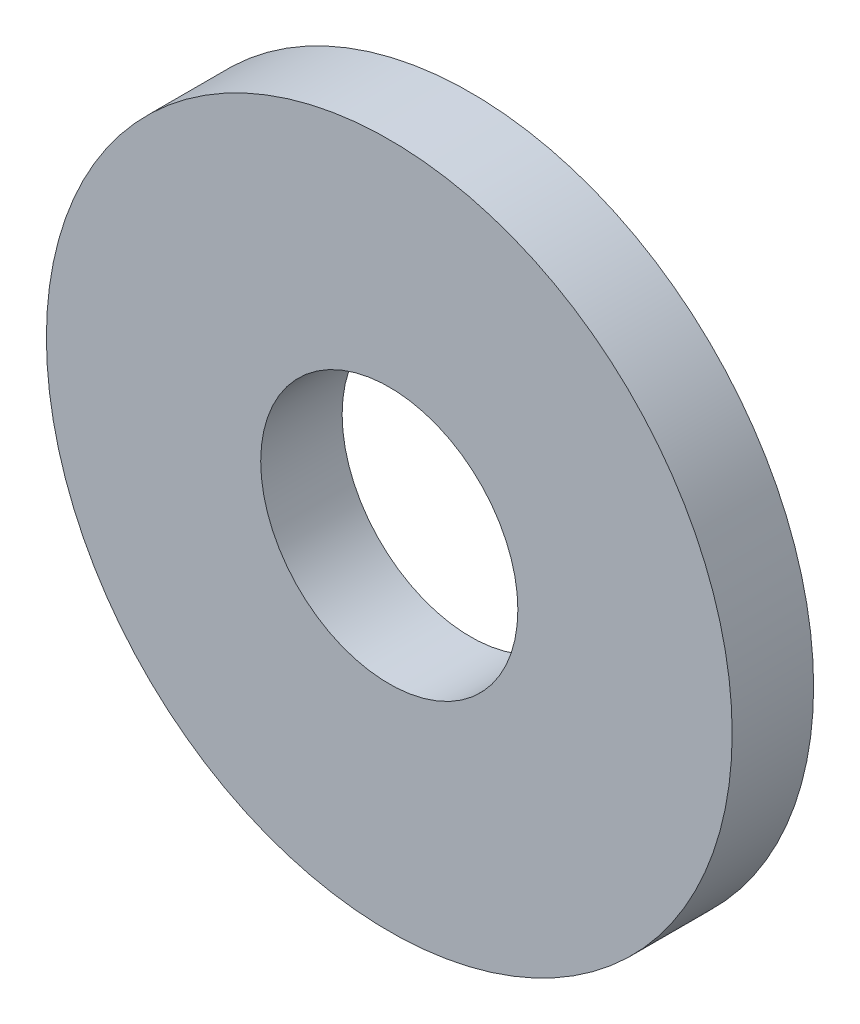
SolidWorks part; units mm, degrees
ref_plane "Plan1" through (0, 0, 0) normal (0, 0, 1) x (1, 0, 0)
ref_plane "Plan2" through (0, 0, 0) normal (0, 1, 0) x (1, 0, 0)
ref_plane "Plan3" through (0, 0, 0) normal (1, 0, 0) x (0, 0, -1)
sketch "Esquisse1" plane through (0, 0, 0) normal (0, 0, 1) x (1, 0, 0)
  circle A0 centre (0, 0) radius 3
  circle A1 centre (0, 0) radius 8
  dimension "D1" = 16
  dimension "D2" = 6
extrude "BASE" add sketch "Esquisse1" along normal blind 1.9
